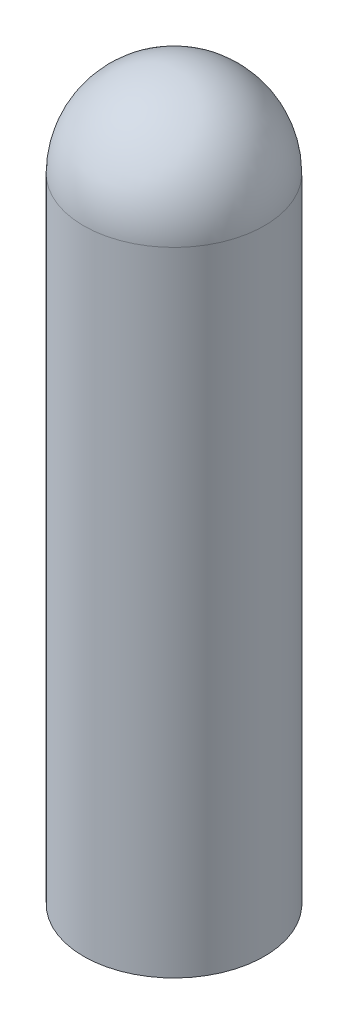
SolidWorks part; units mm, degrees
ref_plane "Front Plane" through (0, 0, 0) normal (0, 0, 1) x (1, 0, 0)
ref_plane "Top Plane" through (0, 0, 0) normal (0, 1, 0) x (1, 0, 0)
ref_plane "Right Plane" through (0, 0, 0) normal (1, 0, 0) x (0, 0, -1)
other "Center of Mass"
sketch "Sketch1" plane through (0, 0, 0) normal (0, 1, 0) x (1, 0, 0)
  circle A0 centre (0, 0) radius 5
  dimension "D1" = 10
extrude "Boss-Extrude1" add sketch "Sketch1" along normal blind 40
fillet "Fillet7" radius 5 1 edges at (0, 40, 5)
sketch "Sketch2" plane through (0, 0, 0) normal (0, -1, 0) x (1, 0, 0)
  point P0 (0, 0)
hole_wizard "Tap Drill for #10-32 Tap1" positions "Sketch3" profile "Sketch5" hole size "#10-32" standard "ANSI Inch"
sketch "Sketch3" plane through (0, 0, 0) normal (0, -1, 0) x (-1, 0, 0)
  point P0 (0, 0)
sketch "Sketch5" plane through (0, 0, 0) normal (1, 0, 0) x (0, 0, -1)
  line L0 (0, 0) -> (0, 36.2133)
  line L1 (0, 36.2133) -> (2.0193, 35)
  line L2 (2.0193, 35) -> (2.0193, 0)
  line L5 (2.0193, 0) -> (0, 0)
  line L10 (0, 36.2133) -> (-2.0193, 35) construction
  line L11 (0, -6.35) -> (0, 107.95) construction
  dimension "Hole Dia." = 4.0386
  dimension "Hole Depth" = 35
  dimension "Drill Angle" = 118
